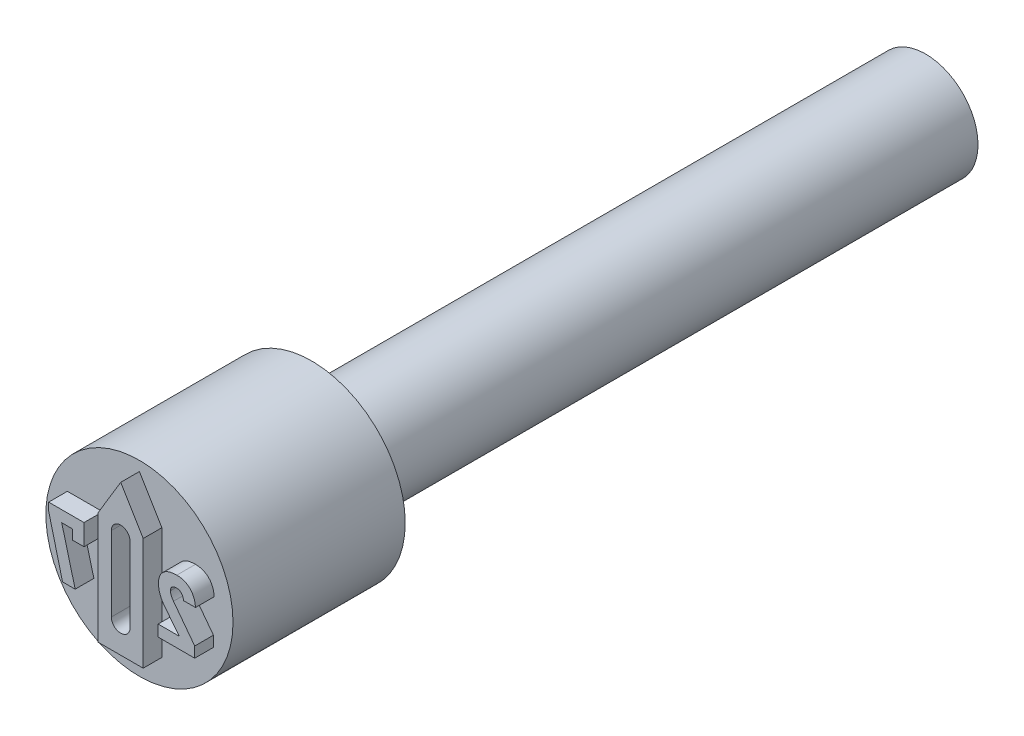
SolidWorks part; units mm, degrees
ref_plane "Front Plane" through (0, 0, 0) normal (0, 0, 1) x (1, 0, 0)
ref_plane "Top Plane" through (0, 0, 0) normal (0, 1, 0) x (1, 0, 0)
ref_plane "Right Plane" through (0, 0, 0) normal (1, 0, 0) x (0, 0, -1)
sketch "Sketch2" plane through (0, 0, 0) normal (1, 0, 0) x (0, 0, -1)
  line L0 (0.4039, 0) -> (50000.4039, 0) construction
  line L6 (0, 1.25) -> (0, 0)
  line L7 (2.3, 1.25) -> (0, 1.25)
  line L8 (2.3, 0.7) -> (2.3, 1.25)
  line L9 (10.5, 0.7) -> (2.3, 0.7)
  line L10 (10.5, 0) -> (10.5, 0.7)
  line L11 (0, 0) -> (10.5, 0)
  dimension "D1" = 2.5
  dimension "D2" = 1.4
  dimension "D3" = 10.5
  dimension "D4" = 2.3
revolve "Revolve1" add sketch "Sketch2" angle 360 about L0
sketch "Sketch3" plane through (0, 0, 0) normal (0, 0, 1) x (1, 0, 0)
  line L0 (0, 0) -> (0, 50000) construction
  line L1 (-0.3, -0.88) -> (0.3, -0.88)
  line L2 (0.3, -0.88) -> (0.3, 0.62)
  line L3 (0.3, 0.62) -> (0, 1.12)
  line L4 (0, 1.12) -> (-0.3, 0.6214)
  line L5 (-0.3, 0.6214) -> (-0.3, -0.88)
  text T0 "2   7" font "Bahnschrift" height 0.83
  dimension "D1" = 0.88
  dimension "D2" = 1.5
  dimension "D3" = 0.5
  dimension "D4" = 62
  dimension "D5" = 0.6
  dimension "D6" = 0.3
  dimension "D7" = 0.42
  dimension "D8" = 1.05
extrude "Boss-Extrude1" add sketch "Sketch3" along normal blind 0.25
sketch "Sketch4" plane through (0, 0, 0.25) normal (0, 0, 1) x (1, 0, 0)
  line L2 (-0.125, 0.5) -> (-0.125, -0.5)
  line L4 (0.125, 0.5) -> (0.125, -0.5)
  arc A0 (0.125, 0.5) -> (-0.125, 0.5) centre (0, 0.5) ccw
  arc A1 (-0.125, -0.5) -> (0.125, -0.5) centre (0, -0.5) ccw
  dimension "D1" = 0.25
  dimension "D2" = 0.125
  dimension "D3" = 1
  dimension "D4" = 0.5
extrude "Cut-Extrude1" cut sketch "Sketch4" against normal blind 0.25
